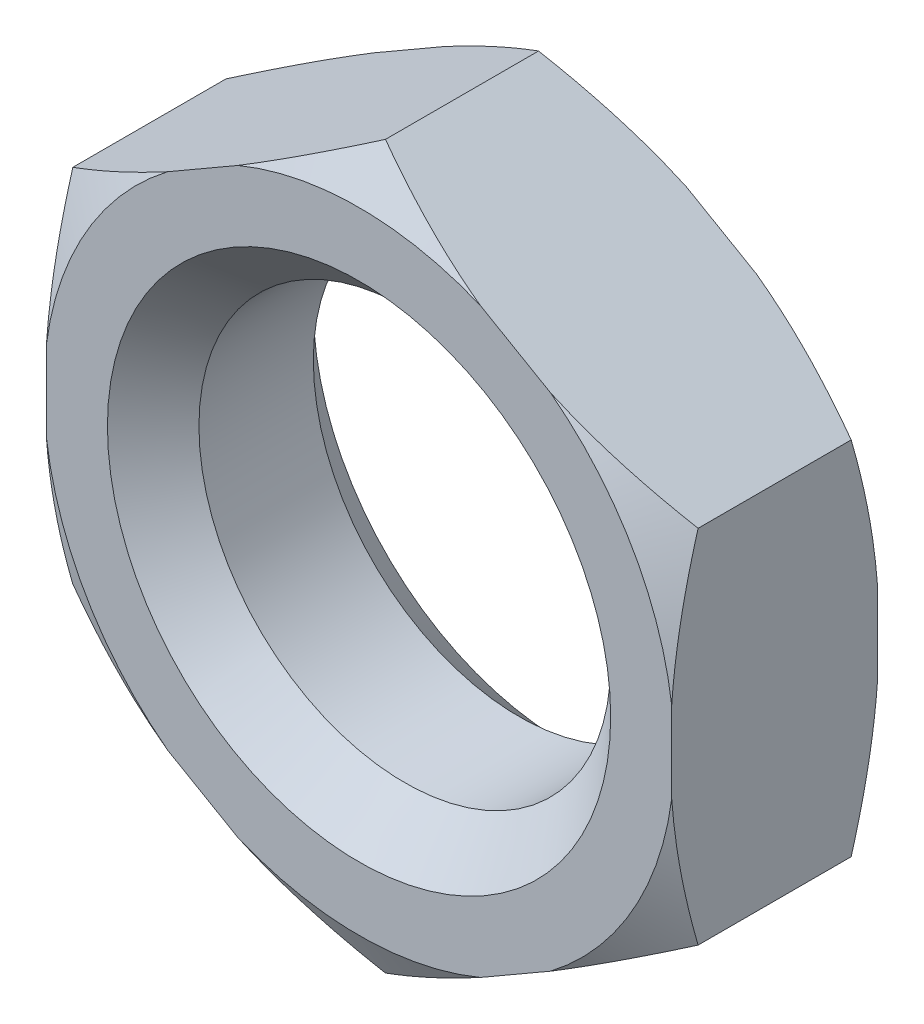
SolidWorks part; units mm, degrees
ref_plane "Front Plane" through (0, 0, 0) normal (0, 0, 1) x (1, 0, 0)
ref_plane "Top Plane" through (0, 0, 0) normal (0, 1, 0) x (1, 0, 0)
ref_plane "Right Plane" through (0, 0, 0) normal (1, 0, 0) x (0, 0, -1)
sketch "Sketch3" plane through (0, 0, 0) normal (0, 0, 1) x (1, 0, 0)
  line L1 (0, 23.6714) -> (-20.5, 11.8357)
  line L2 (-20.5, 11.8357) -> (-20.5, -11.8357)
  line L3 (-20.5, -11.8357) -> (0, -23.6714)
  line L4 (0, -23.6714) -> (20.5, -11.8357)
  line L5 (20.5, -11.8357) -> (20.5, 11.8357)
  line L6 (20.5, 11.8357) -> (0, 23.6714)
  circle A0 centre (0, 0) radius 20.5 construction
  dimension "D1" = 41
extrude "Boss-Extrude1" add sketch "Sketch3" along normal mid plane 13.5
sketch "Sketch4" plane through (0, 0, 0) normal (1, 0, 0) x (0, 0, -1)
  line L0 (-5.4578, 0) -> (6.1545, 0) construction
sketch "Sketch5" plane through (0, 0, 0) normal (1, 0, 0) x (0, 0, -1)
  line L0 (-6.75, 23.6714) -> (-6.75, 20.6714)
  line L1 (-6.75, 11.8357) -> (-6.75, 23.6714) construction
  line L2 (-6.75, 20.6714) -> (-5.0179, 23.6714)
  line L3 (-6.75, 23.6714) -> (6.75, 23.6714) construction
  line L4 (-5.0179, 23.6714) -> (-6.75, 23.6714)
  dimension "D1" = 3
  dimension "D2" = 30
revolve "Cut-Revolve1" cut sketch "Sketch5" angle 360 about L0
mirror "Mirror1" about plane through (0, 0, 0) normal (0, 0, 1) of "Cut-Revolve1"
sketch "Sketch6" plane through (0, 0, 6.75) normal (0, 0, 1) x (1, 0, 0)
  circle A0 centre (0, 0) radius 13.5
  dimension "D1" = 27
extrude "Cut-Extrude1" cut sketch "Sketch6" against normal blind 13.5
chamfer "Chamfer1" distance 3 angle 45 2 edges at (13.5, 0, -6.75) (13.5, 0, 6.75)
